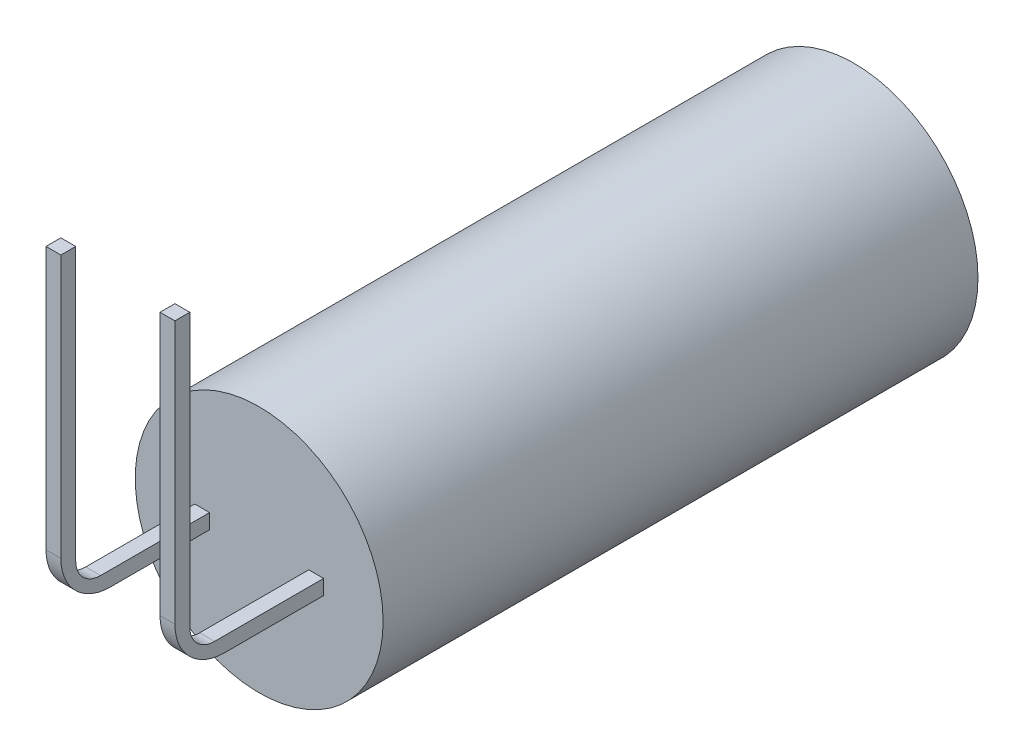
SolidWorks part; units mm, degrees
ref_plane "Plan de face" through (0, 0, 0) normal (0, 0, 1) x (1, 0, 0)
ref_plane "Plan de dessus" through (0, 0, 0) normal (0, 1, 0) x (1, 0, 0)
ref_plane "Plan de droite" through (0, 0, 0) normal (1, 0, 0) x (0, 0, -1)
sketch "Esquisse2" plane through (0, 0, 0) normal (0, 0, 1) x (1, 0, 0)
  circle A0 centre (0, 0) radius 2.5 construction
  circle A3 centre (0, 0) radius 2.5
extrude "Extrusion1" add sketch "Esquisse2" against normal blind 12
sketch "Esquisse5" plane through (0, 0, 0) normal (0, 0, 1) x (1, 0, 0)
  line L0 (0, 1.0031) -> (0, -1.0758) construction
  line L1 (-1.3, 0.15) -> (-1, 0.15)
  line L2 (-1.3, 0.15) -> (-1.3, -0.15)
  line L3 (-1.3, -0.15) -> (-1, -0.15)
  line L4 (-1, 0.15) -> (-1, -0.15)
  line L5 (1.3, 0.15) -> (1.3, -0.15)
  line L6 (1.3, 0.15) -> (1, 0.15)
  line L7 (1, 0.15) -> (1, -0.15)
  line L8 (1.3, -0.15) -> (1, -0.15)
  dimension "D1" = 1
  dimension "D2" = 0.15
  dimension "D3" = 0.15
  dimension "D4" = 1.3
extrude "Extrusion3" add sketch "Esquisse5" along normal blind 3
sketch "Esquisse6" plane through (0, 0.15, 0) normal (0, 1, 0) x (-1, 0, 0)
  line L0 (1, 3) -> (1, 0) construction
  line L1 (1.3, 3) -> (1, 3)
  line L2 (1.3, 3) -> (1.3, 2.7)
  line L3 (1.3, 2.7) -> (1, 2.7)
  line L4 (1, 3) -> (1, 2.7)
  line L5 (-1.3, 3) -> (-1.3, 0) construction
  line L6 (-1, 3) -> (-1.3, 3)
  line L7 (-1, 3) -> (-1, 2.7)
  line L8 (-1, 2.7) -> (-1.3, 2.7)
  line L9 (-1.3, 3) -> (-1.3, 2.7)
  dimension "D1" = 0.3
  dimension "D2" = 0.3
extrude "Extrusion4" add sketch "Esquisse6" along normal blind 6
fillet "Congé1" radius 0.5 2 edges at (1.15, 0.15, 2.7) (-1.15, 0.15, 2.7)
fillet "Congé2" radius 1 2 edges at (-1.15, -0.15, 3) (1.15, -0.15, 3)
